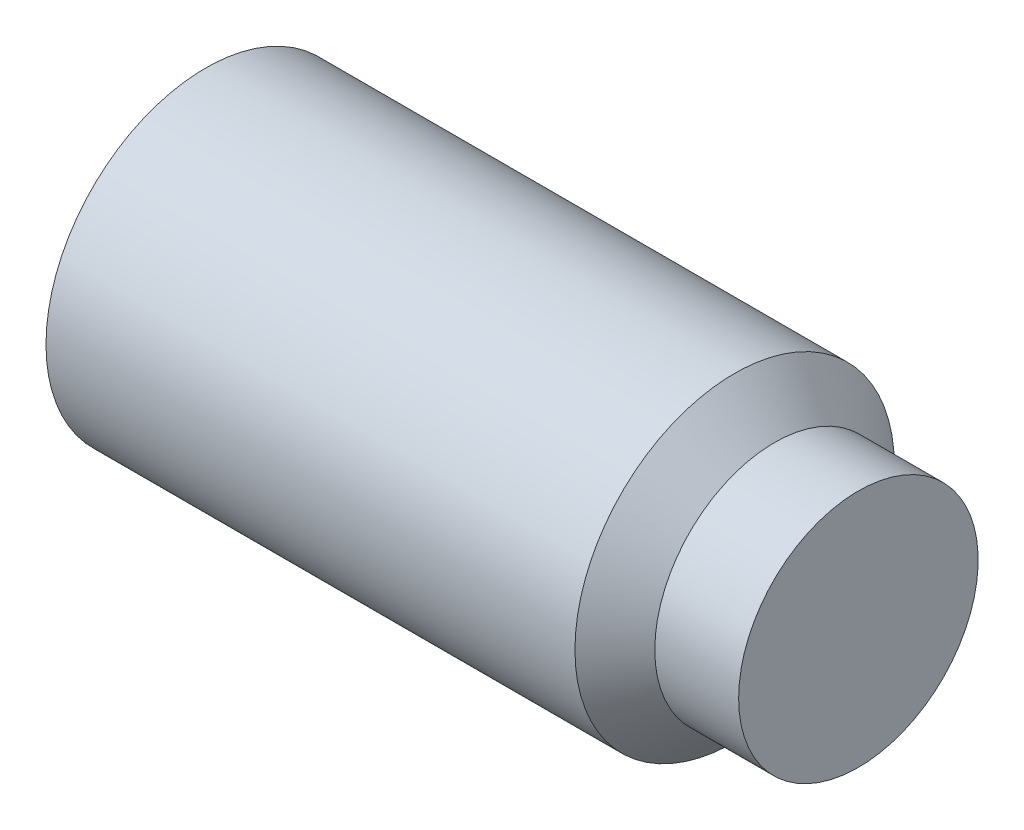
SolidWorks part; units mm, degrees
ref_plane "Plane1" through (0, 0, 0) normal (0, 0, 1) x (1, 0, 0)
ref_plane "Plane2" through (0, 0, 0) normal (0, 1, 0) x (1, 0, 0)
ref_plane "Plane3" through (0, 0, 0) normal (1, 0, 0) x (0, 0, -1)
sketch "BodySke" plane through (0, 0, 0) normal (0, 0, 1) x (1, 0, 0)
  line L0 (0, 0) -> (0, 10.352)
  line L1 (0, 10.352) -> (0.9515, 12)
  line L2 (0.9515, 12) -> (40.7, 12)
  line L3 (40.7, 12) -> (43.7, 9)
  line L4 (50, 0) -> (0, 0)
  line L5 (-12.7, 0) -> (88.9, 0) construction
  line L6 (43.7, 9) -> (50, 9)
  line L7 (50, 9) -> (50, 0)
  line L8 (0, -10.352) -> (0.9515, -12) construction
  line L9 (43.7, -9) -> (50, -9) construction
  line L10 (1.5, 15.875) -> (1.5, -3.175) construction
  dimension "D1" = 45
  dimension "Length" = 50
  dimension "Diameter" = 24
  dimension "Drive_ch_ang" = 60
  dimension "Minor_dia" = 20.704
  dimension "Dog_dia" = 18
  dimension "Dog_len" = 6.3
  dimension "Advance" = 3
revolve "BaseBody" add sketch "BodySke" angle 360 about L5
sketch "Sketch2" plane through (0, 0, 0) normal (-1, 0, 0) x (0, 0, 1)
  line L0 (3.4641, 6) -> (-3.4641, 6)
  line L1 (-3.4641, 6) -> (-6.9282, 0)
  line L2 (3.4641, 6) -> (6.9282, 0)
  line L3 (3.4641, -6) -> (6.9282, 0)
  line L4 (3.4641, -6) -> (-3.4641, -6)
  line L5 (-3.4641, -6) -> (-6.9282, 0)
  dimension "Hex_size" = 12
  dimension "D2" = 6
  dimension "D3" = 6
extrude "Hex" cut sketch "Sketch2" against normal blind 15
sketch "ThdSchSke" plane through (0, 0, 0) normal (0, 0, 1) x (1, 0, 0)
  line L0 (0.9515, -10.352) -> (-0.2025, -12)
  line L1 (0.9515, -10.352) -> (2.1054, -12)
  line L2 (2.1054, -12) -> (2.1054, -15)
  line L3 (-3.175, 0) -> (5.1513, 0) construction
  line L4 (0.9515, 12) -> (0.9515, -12) construction
  line L5 (2.1054, -15) -> (-0.2025, -15)
  line L6 (-0.2025, -15) -> (-0.2025, -12)
  dimension "Thread_minor" = 20.704
  dimension "Diameter" = 24
  dimension "SideAngle" = 55
  dimension "VeeAngle" = 70
  dimension "Overcut" = 30
revolve "ThreadSchematic" [suppressed] cut sketch "ThdSchSke" angle 360 about L3
pattern_linear "ThdSchPat" [suppressed]
equation "\"D2@Sketch2\" = \"Hex_size@Sketch2\" / 2"
equation "\"D3@Sketch2\" = \"Hex_size@Sketch2\" / 2"
equation "\"Thread_minor@ThreadCosmetic\" = \"Minor_dia@BodySke\""
equation "\"Thread_minor@ThdSchSke\" = \"Thread_minor@ThreadCosmetic\""
equation "\"Diameter@ThdSchSke\" = \"Diameter@BodySke\""
equation "\"Overcut@ThdSchSke\" = \"Diameter@BodySke\" * 1.25"
equation "\"Num_threads@ThdSchPat\" = int( (\"Length@BodySke\" - ( ( ( \"Diameter@BodySke\" - \"Minor_dia@BodySke\" ) * 0.5 ) / tan( \"Drive_ch_ang@BodySke\" * 0.017453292 ) ) - \"Dog_len@BodySke\" ) / \"Advance@BodySke\" + "
equation "\"Advance@ThdSchPat\" = (\"Length@BodySke\" - ( ( ( \"Diameter@BodySke\" - \"Minor_dia@BodySke\" ) * 0.5 ) / tan( \"Drive_ch_ang@BodySke\" * 0.017453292 ) ) - \"Dog_len@BodySke\" ) /  (\"Num_threads@ThdSchPat\" - 1"
equation "\"Num_threads@ThdSchPat\" = \"Num_threads@ThdSchPat\" - sgn( \"Num_threads@ThdSchPat\" - 1) '---chamfered tips only---"
